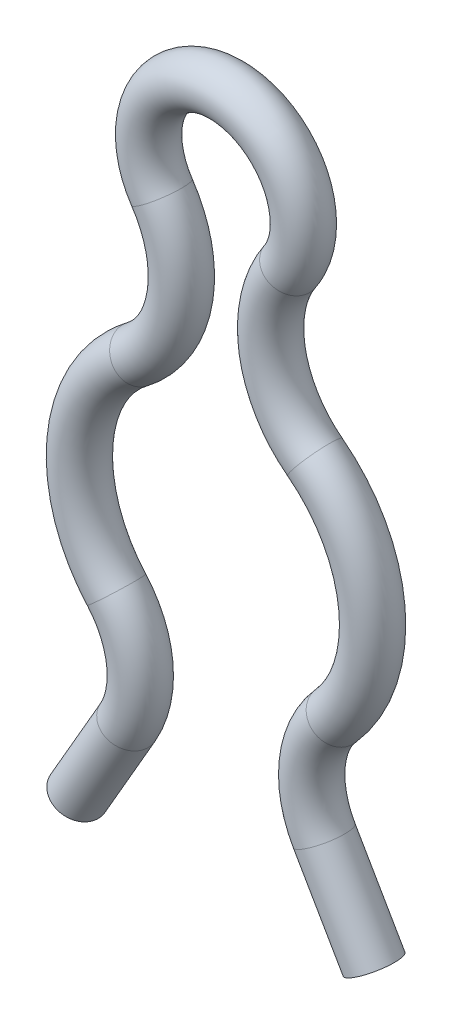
SolidWorks part; units mm, degrees
ref_plane "Front Plane" through (0, 0, 0) normal (0, 0, 1) x (1, 0, 0)
ref_plane "Top Plane" through (0, 0, 0) normal (0, 1, 0) x (1, 0, 0)
ref_plane "Right Plane" through (0, 0, 0) normal (1, 0, 0) x (0, 0, -1)
sketch "Sketch1" plane through (0, 0, 0) normal (0, 0, 1) x (1, 0, 0)
  line L0 (0, 0) -> (0, 5.08) construction
  line L1 (2.406, -4.7625) -> (1.5961, -3.3598) construction
  line L2 (-2.406, -4.7625) -> (-1.5961, -3.3598) construction
  circle A0 centre (0, 0) radius 2.3812 construction
  circle A1 centre (0, 5.08) radius 1.2573 construction
  arc A2 (1.5961, -3.3598) -> (1.778, -1.584) centre (2.9159, -2.5978) cw construction
  arc A3 (1.0404, 4.374) -> (1.4444, 1.8932) centre (2.5537, 3.3471) ccw construction
  arc A4 (-1.5961, -3.3598) -> (-1.778, -1.584) centre (-2.9159, -2.5978) ccw construction
  arc A5 (-1.0404, 4.374) -> (-1.4444, 1.8932) centre (-2.5537, 3.3471) cw construction
  dimension "D1" = 4.7625
  dimension "D2" = 2.5146
  dimension "D3" = 5.08
  dimension "D5" = 1.524
  dimension "D6" = 1.8288
  dimension "D4" = 30
  dimension "D7" = 3.556
  dimension "D8" = 4.7625
sketch "Sketch2" plane through (0, 0, 0) normal (0, 0, 1) x (1, 0, 0)
  line L0 (-2.406, -4.7625) -> (-1.5961, -3.3598) construction
  line L1 (2.406, -4.7625) -> (1.5961, -3.3598) construction
  line L2 (-2.406, -4.7625) -> (-1.5961, -3.3598)
  line L3 (2.406, -4.7625) -> (1.5961, -3.3598)
  circle A0 centre (0, 0) radius 2.3812 construction
  arc A1 (-1.5961, -3.3598) -> (-1.778, -1.584) centre (-2.9159, -2.5978) ccw construction
  arc A2 (1.778, -1.584) -> (1.5961, -3.3598) centre (2.9159, -2.5978) ccw construction
  arc A3 (1.0404, 4.374) -> (1.4444, 1.8932) centre (2.5537, 3.3471) ccw construction
  circle A4 centre (0, 5.08) radius 1.2573 construction
  arc A5 (-1.4444, 1.8932) -> (-1.0404, 4.374) centre (-2.5537, 3.3471) ccw construction
  arc A6 (-1.4444, 1.8932) -> (-1.778, -1.584) centre (0, 0) ccw
  arc A7 (-1.5961, -3.3598) -> (-1.778, -1.584) centre (-2.9159, -2.5978) ccw
  arc A8 (1.778, -1.584) -> (1.5961, -3.3598) centre (2.9159, -2.5978) ccw
  arc A9 (1.0404, 4.374) -> (1.4444, 1.8932) centre (2.5537, 3.3471) ccw
  arc A10 (1.0404, 4.374) -> (-1.0404, 4.374) centre (0, 5.08) ccw
  arc A11 (-1.4444, 1.8932) -> (-1.0404, 4.374) centre (-2.5537, 3.3471) ccw
  arc A12 (1.778, -1.584) -> (1.4444, 1.8932) centre (0, 0) ccw
ref_plane "Plane1" through (-2.406, -4.7625, 0) normal (0.5, 0.866, 0) x (0.866, -0.5, 0)
sketch "Sketch3" plane through (-2.406, -4.7625, 0) normal (0.5, 0.866, 0) x (0.866, -0.5, 0)
  circle A0 centre (0, 0) radius 0.381
  dimension "D1" = 0.762
sweep "Sweep1" add profiles "Sketch3" path "Sketch2"
